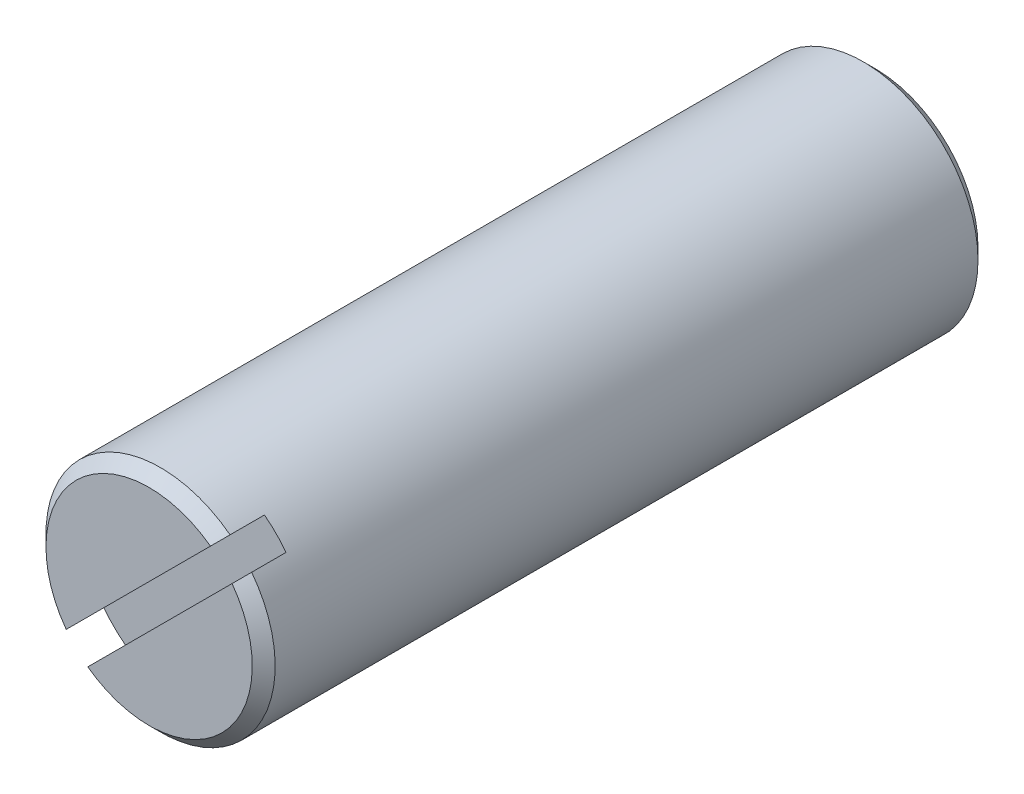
SolidWorks part; units mm, degrees
ref_plane "Face" through (0, 0, 0) normal (0, 0, 1) x (1, 0, 0)
ref_plane "Dessus" through (0, 0, 0) normal (0, 1, 0) x (1, 0, 0)
ref_plane "Droite" through (0, 0, 0) normal (1, 0, 0) x (0, 0, -1)
sketch "Esquisse1" plane through (0, 0, 0) normal (0, 0, 1) x (1, 0, 0)
  circle A0 centre (0, 0) radius 15
  dimension "D1" = 30
extrude "Base-Extrusion" add sketch "Esquisse1" along normal blind 95
chamfer "Chanfrein1" distance 1.5 angle 45 2 edges at (15, 0, 0) (15, 0, 95)
ref_plane "Plan3" through (15, 0, 0) normal (1, 0, 0) x (0, 0, -1)
sketch "Esquisse2" plane through (15, 0, 0) normal (1, 0, 0) x (0, 0, -1)
  line L0 (0, -13.5) -> (0, 13.5) construction
  line L1 (-20, -13) -> (-75, -13)
  line L2 (-20, -13) -> (-20, -18)
  line L3 (-20, -18) -> (-75, -18)
  line L4 (-75, -13) -> (-75, -18)
  line L5 (0, -13.5) -> (0, 13.5) construction
  line L6 (-1.5, 15) -> (-93.5, 15) construction
  line L7 (-1.5, 15) -> (-93.5, 15) construction
  dimension "D1" = 55
  dimension "D2" = 20
  dimension "D3" = 28
  dimension "D4" = 5
extrude "Méplat" cut sketch "Esquisse2" against normal through all
sketch "Esquisse3" plane through (0, 0, 95) normal (0, 0, 1) x (1, 0, 0)
  line L0 (-11.8293, -11.8293) -> (11.8293, 11.8293) construction
  line L1 (-21.445, 0) -> (21.445, 0) construction
  line L2 (-10.9602, -13.7886) -> (13.7886, 10.9602)
  line L3 (13.7886, 10.9602) -> (10.9602, 13.7886)
  line L4 (10.9602, 13.7886) -> (-13.7886, -10.9602)
  line L5 (-13.7886, -10.9602) -> (-10.9602, -13.7886)
  dimension "D1" = 45
  dimension "D2" = 4
  dimension "D3" = 35
  dimension "D4" = 17.5
extrude "Rainure" cut sketch "Esquisse3" against normal blind 6
ref_plane "Plan4" through (0, 0, 47.5) normal (0, 0, 1) x (1, 0, 0)
sketch "Esq_WRNL_Compact001" plane through (0, 0, 0) normal (0, 0, 1) x (1, 0, 0)
  line L0 (-16, -16) -> (-16, 16)
  line L1 (16, -16) -> (16, 16)
  line L2 (-16, -16) -> (16, -16)
  line L3 (-16, 16) -> (16, 16)
